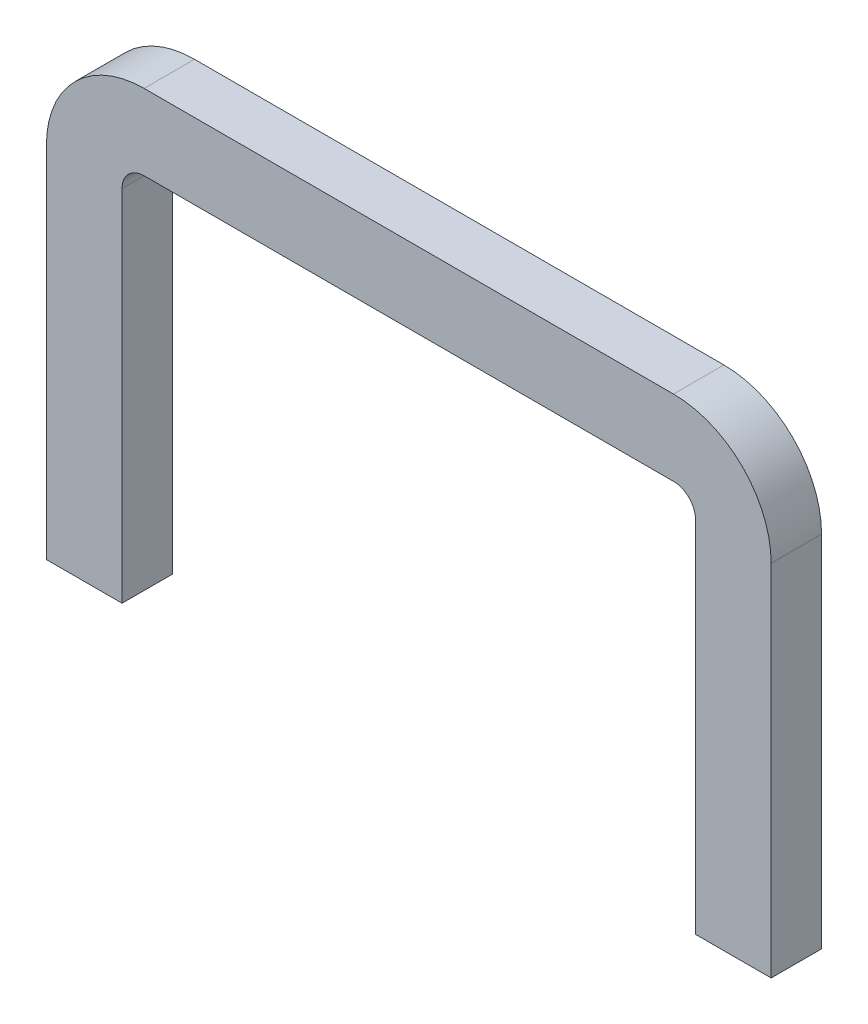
SolidWorks part; units mm, degrees
ref_plane "Спереди" through (0, 0, 0) normal (0, 0, 1) x (1, 0, 0)
ref_plane "Сверху" through (0, 0, 0) normal (0, 1, 0) x (1, 0, 0)
ref_plane "Справа" through (0, 0, 0) normal (1, 0, 0) x (0, 0, -1)
sketch "Эскиз1" plane through (0, 0, 0) normal (0, 0, 1) x (1, 0, 0)
  line L0 (57.5, 26.75) -> (57.5, -30.25)
  line L1 (-42, 30.25) -> (42, 30.25)
  line L2 (-45.5, 26.75) -> (-45.5, -30.25)
  line L3 (-42, 42.25) -> (42, 42.25)
  line L4 (45.5, 26.75) -> (45.5, -30.25)
  line L5 (-45.5, 30.25) -> (45.5, -30.25) construction
  line L6 (-45.5, -30.25) -> (45.5, 30.25) construction
  line L7 (-57.5, 26.75) -> (-57.5, -30.25)
  line L8 (-57.5, -30.25) -> (-45.5, -30.25)
  line L9 (57.5, -30.25) -> (45.5, -30.25)
  arc A0 (-42, 30.25) -> (-45.5, 26.75) centre (-42, 26.75) ccw
  arc A1 (42, 30.25) -> (45.5, 26.75) centre (42, 26.75) cw
  arc A2 (42, 42.25) -> (57.5, 26.75) centre (42, 26.75) cw
  arc A3 (-42, 42.25) -> (-57.5, 26.75) centre (-42, 26.75) ccw
  point P0 (0, 0)
  dimension "D1" = 3.5
  dimension "D2" = 3.5
  dimension "D3" = 12
extrude "Бобышка-Вытянуть1" add sketch "Эскиз1" along normal blind 8
